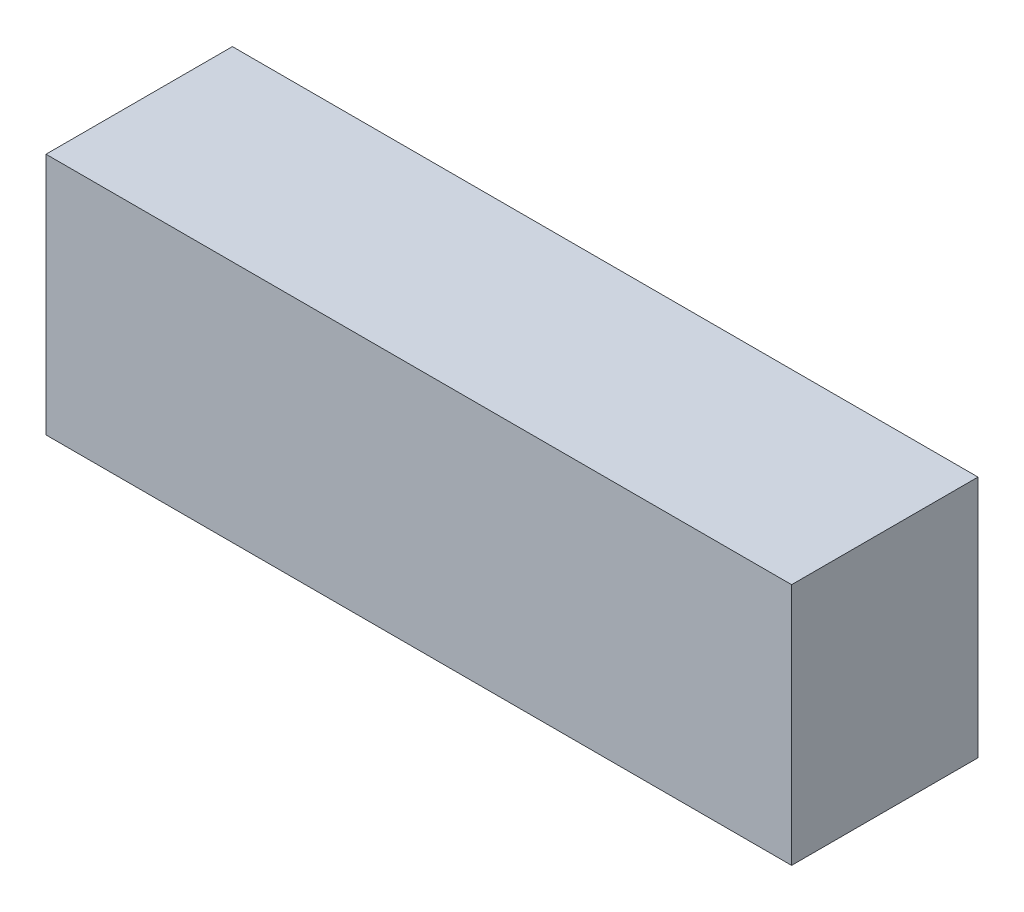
SolidWorks part; units mm, degrees
ref_plane "Front Plane" through (0, 0, 0) normal (0, 0, 1) x (1, 0, 0)
ref_plane "Top Plane" through (0, 0, 0) normal (0, 1, 0) x (1, 0, 0)
ref_plane "Right Plane" through (0, 0, 0) normal (1, 0, 0) x (0, 0, -1)
sketch "Sketch1" plane through (0, 0, 0) normal (0, 1, 0) x (1, 0, 0)
  line L1 (-115, 28.75) -> (115, 28.75)
  line L2 (-115, 28.75) -> (-115, -28.75)
  line L3 (-115, -28.75) -> (115, -28.75)
  line L4 (115, 28.75) -> (115, -28.75)
  line L5 (-115, 28.75) -> (115, -28.75) construction
  line L6 (-115, -28.75) -> (115, 28.75) construction
  point P0 (0, 0)
  dimension "D1" = 230
  dimension "D2" = 57.5
extrude "Boss-Extrude1" add sketch "Sketch1" along normal mid plane 75
